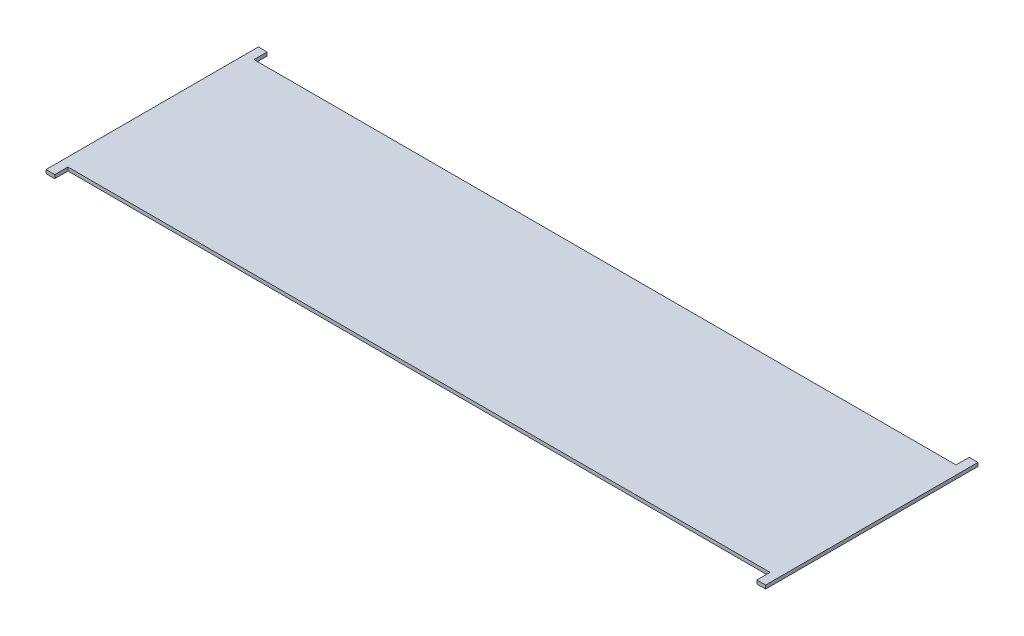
SolidWorks part; units mm, degrees
ref_plane "Front" through (0, 0, 0) normal (0, 0, 1) x (1, 0, 0)
ref_plane "Top" through (0, 0, 0) normal (0, 1, 0) x (1, 0, 0)
ref_plane "Right" through (0, 0, 0) normal (1, 0, 0) x (0, 0, -1)
ref_plane "Plane1" through (0, 3, 0) normal (0, 1, 0) x (1, 0, 0)
sketch "Sketch1" plane through (0, 3, 0) normal (0, 1, 0) x (1, 0, 0)
  line L0 (0, 0) -> (800, 0)
  line L1 (800, 212) -> (800, 227)
  line L2 (800, 212) -> (0, 212)
  line L3 (0, 212) -> (0, 0)
  line L4 (800, 227) -> (810, 227)
  line L5 (0, 227) -> (-10, 227)
  line L6 (0, 227) -> (0, -15)
  line L7 (0, -15) -> (-10, -15)
  line L8 (-10, 227) -> (-10, -15)
  line L9 (810, 227) -> (810, -15)
  line L10 (810, -15) -> (800, -15)
  line L11 (800, -15) -> (800, 0)
  dimension "D2" = 212
  dimension "D3" = 0
  dimension "D4" = 15
  dimension "D5" = 15
  dimension "D6" = 10
  dimension "D7" = 0
extrude "Boss-Extrude1" add sketch "Sketch1" against normal blind 4
